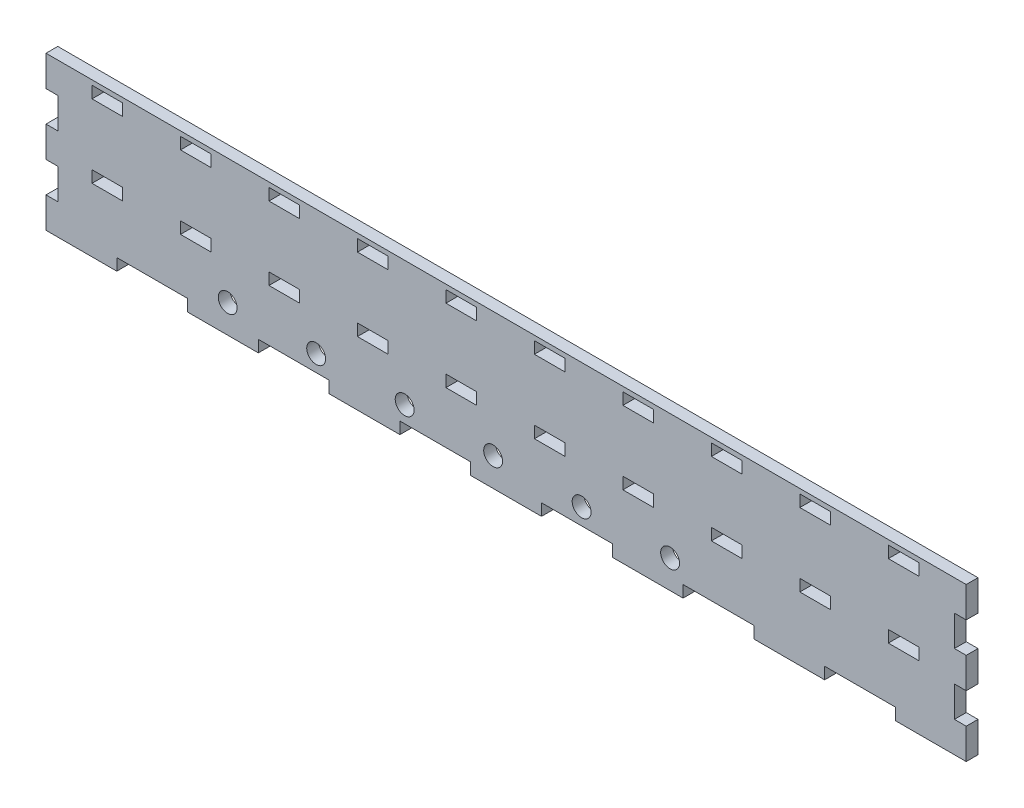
SolidWorks part; units mm, degrees
ref_plane "Plan de face" through (0, 0, 0) normal (0, 0, 1) x (1, 0, 0)
ref_plane "Plan de dessus" through (0, 0, 0) normal (0, 1, 0) x (1, 0, 0)
ref_plane "Plan de droite" through (0, 0, 0) normal (1, 0, 0) x (0, 0, -1)
sketch "Esquisse1" plane through (0, 0, 0) normal (0, 0, 1) x (1, 0, 0)
  line L1 (0, 0) -> (390, 0)
  line L2 (0, 0) -> (0, -65)
  line L3 (0, -65) -> (390, -65)
  line L4 (390, 0) -> (390, -65)
extrude "Boss.-Extru.1" add sketch "Esquisse1" along normal blind 5
sketch "Esquisse2" plane through (0, 0, 5) normal (0, 0, 1) x (1, 0, 0)
  line L0 (0, -65) -> (390, -65) construction
  line L1 (30, -65) -> (60, -65)
  line L2 (30, -65) -> (30, -60)
  line L3 (30, -60) -> (60, -60)
  line L4 (60, -65) -> (60, -60)
  line L5 (0, 0) -> (390, 0) construction
  line L6 (0, 0) -> (0, -65) construction
extrude "Enlèv. mat.-Extru.1" cut sketch "Esquisse2" against normal blind 5
pattern_linear "Répétition linéaire1" count 6 spacing 60 along (1, 0, 0) of "Enlèv. mat.-Extru.1"
sketch "Esquisse3" plane through (0, 0, 5) normal (0, 0, 1) x (1, 0, 0)
  line L0 (0, 0) -> (0, -65) construction
  line L1 (0, -52) -> (5, -52)
  line L2 (0, -52) -> (0, -39)
  line L3 (0, -39) -> (5, -39)
  line L4 (5, -52) -> (5, -39)
  line L5 (0, 0) -> (0, -65) construction
  line L6 (0, -65) -> (30, -65) construction
extrude "Enlèv. mat.-Extru.2" cut sketch "Esquisse3" against normal blind 5
pattern_linear "Répétition linéaire2" count 2 spacing 26 along (0, 1, 0) of "Enlèv. mat.-Extru.2"
ref_plane "Plan1" through (195, 0, 0) normal (-1, 0, 0) x (0, 0, 1)
mirror "Symétrie1" about plane through (195, 0, 0) normal (-1, 0, 0) of "Répétition linéaire2", "Enlèv. mat.-Extru.2"
sketch "Esquisse4" plane through (0, 0, 5) normal (0, 0, 1) x (1, 0, 0)
  line L0 (0, -52) -> (0, -65) construction
  line L1 (60, -65) -> (90, -65) construction
  circle A0 centre (77, -53) radius 4
  dimension "D3" = 8
  dimension "D1" = 77
  dimension "D2" = 12
extrude "Enlèv. mat.-Extru.3" cut sketch "Esquisse4" against normal blind 5
pattern_linear "Répétition linéaire3" count 6 spacing 37.5 along (1, 0, 0) of "Enlèv. mat.-Extru.3"
sketch "Esquisse5" plane through (0, 0, 5) normal (0, 0, 1) x (1, 0, 0)
  line L0 (0, -52) -> (0, -65) construction
  line L1 (57, -33) -> (70, -33)
  line L2 (57, -33) -> (57, -38)
  line L3 (57, -38) -> (70, -38)
  line L4 (70, -33) -> (70, -38)
  line L5 (60, -65) -> (90, -65) construction
  line L7 (57, -2) -> (70, -2)
  line L8 (57, -2) -> (57, -7)
  line L9 (57, -7) -> (70, -7)
  line L10 (70, -2) -> (70, -7)
extrude "Enlèv. mat.-Extru.4" cut sketch "Esquisse5" against normal blind 5
pattern_linear "Répétition linéaire4" count 2 spacing 37.5 along (-1, 0, 0) count 9 spacing 37.5 along (1, 0, 0) of "Enlèv. mat.-Extru.4"
equation "\"D1@Esquisse1\"=400-10"
equation "\"D2@Esquisse2\"=\"D1@Esquisse2\"/13"
equation "\"D3@Esquisse2\"=\"D1@Esquisse2\"/13"
equation "\"D2@Esquisse3\"=\"D1@Esquisse3\"/5"
equation "\"D3@Esquisse3\"=\"D1@Esquisse3\"/5"
equation "\"D6@Esquisse5\"=\"D2@Esquisse5\""
